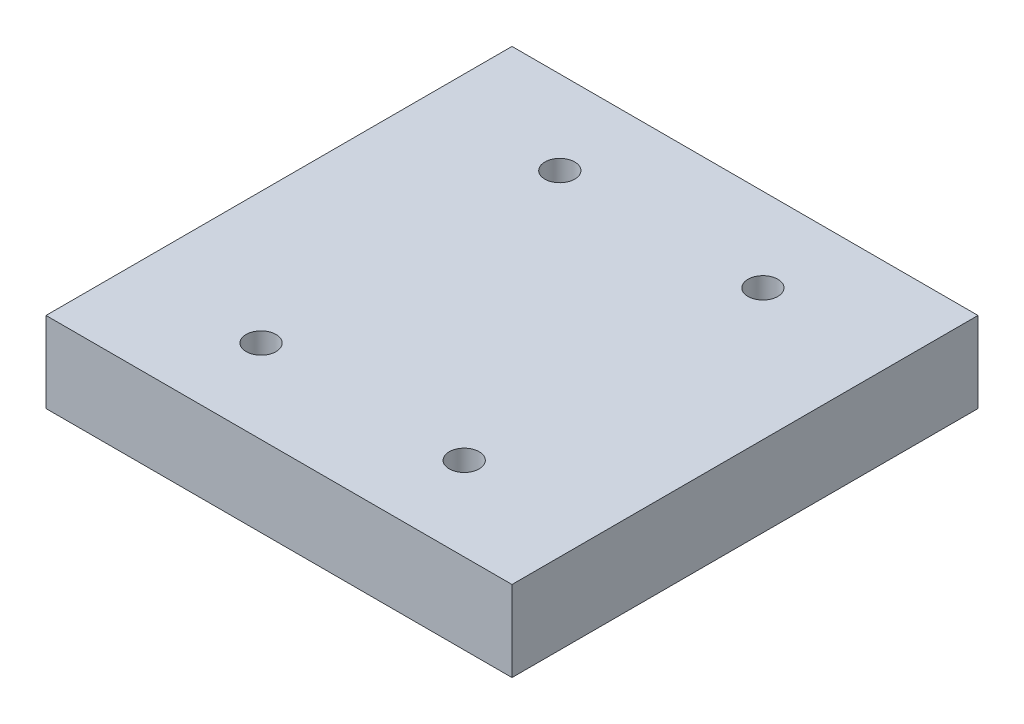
SolidWorks part; units mm, degrees
ref_plane "Plano frontal" through (0, 0, 0) normal (0, 0, 1) x (1, 0, 0)
ref_plane "Plano superior" through (0, 0, 0) normal (0, 1, 0) x (1, 0, 0)
ref_plane "Plano direito" through (0, 0, 0) normal (1, 0, 0) x (0, 0, -1)
sketch "Esboço1" plane through (0, 0, 0) normal (0, 1, 0) x (1, 0, 0)
  line L1 (-78, -78) -> (78, -78)
  line L2 (-78, -78) -> (-78, 78)
  line L3 (-78, 78) -> (78, 78)
  line L4 (78, -78) -> (78, 78)
  line L5 (-78, -78) -> (78, 78) construction
  line L6 (-78, 78) -> (78, -78) construction
  point P0 (0, 0)
  dimension "D1" = 156
  dimension "D2" = 156
extrude "Extrusão1" add sketch "Esboço1" along normal blind 27
sketch "Esboço2" plane through (0, 0, 0) normal (0, -1, 0) x (1, 0, 0)
  line L0 (78, 78) -> (78, -78) construction
  line L1 (-78, 78) -> (78, 78) construction
  circle A0 centre (34, 50) radius 5
  circle A1 centre (-34, 50) radius 5
  circle A2 centre (34, -50) radius 5
  circle A3 centre (-34, -50) radius 5
  dimension "D1" = 10
  dimension "D2" = 44
  dimension "D3" = 28
extrude "Extrusão2" cut sketch "Esboço2" against normal through all
